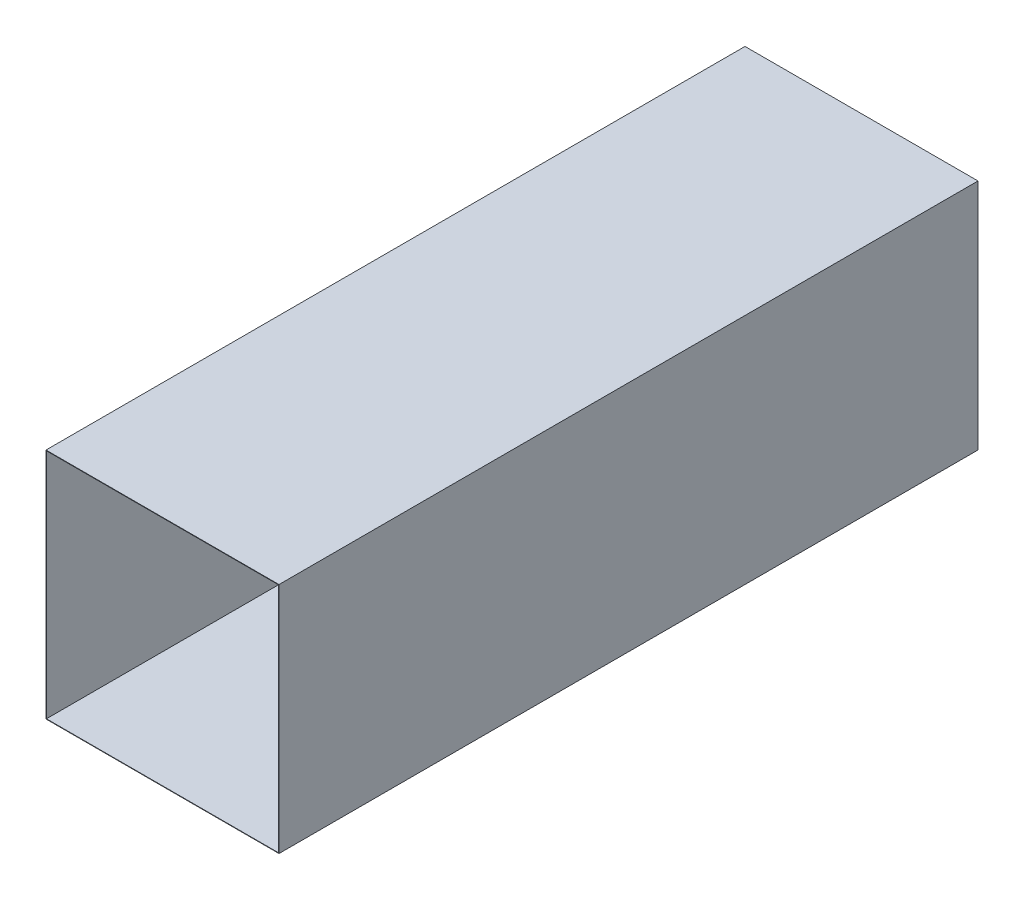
SolidWorks part; units mm, degrees
ref_plane "Front Plane" through (0, 0, 0) normal (0, 0, 1) x (1, 0, 0)
ref_plane "Top Plane" through (0, 0, 0) normal (0, 1, 0) x (1, 0, 0)
ref_plane "Right Plane" through (0, 0, 0) normal (1, 0, 0) x (0, 0, -1)
sketch "DuctSketch" plane through (0, 0, 0) normal (0, 0, 1) x (1, 0, 0)
  line L1 (-500, 500) -> (500, 500)
  line L2 (-500, 500) -> (-500, -500)
  line L3 (-500, -500) -> (500, -500)
  line L4 (500, 500) -> (500, -500)
  line L5 (-500, 500) -> (500, -500) construction
  line L6 (-500, -500) -> (500, 500) construction
  point P0 (0, 0)
  dimension "Height" = 1000
  dimension "Width" = 1000
extrude "Extrusion" add sketch "DuctSketch" along normal blind 3000 thin
sketch "FilterSketch" plane through (0, 0, 0) normal (0, 0, -1) x (-1, 0, 0)
  line L1 (-500, -500) -> (500, -500)
  line L2 (-500, -500) -> (-500, 500)
  line L3 (-500, 500) -> (500, 500)
  line L4 (500, -500) -> (500, 500)
  dimension "NominalHeight" = 1000
  dimension "NominalWidth" = 1000
